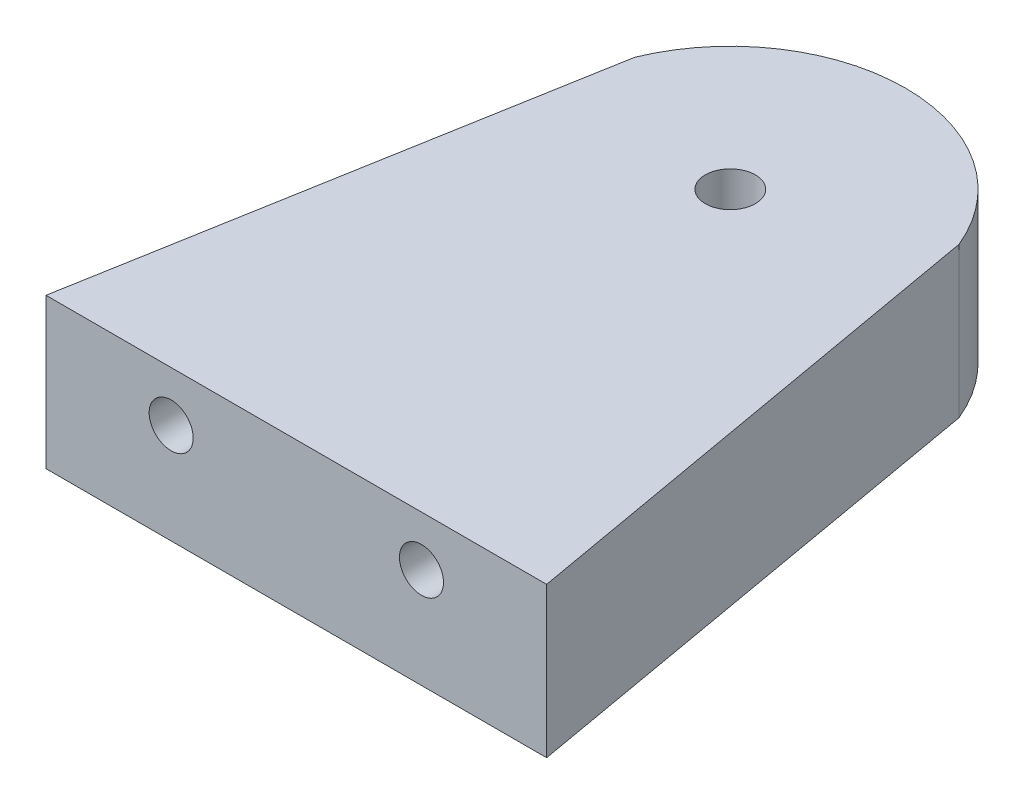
SolidWorks part; units mm, degrees
ref_plane "Alzado" through (0, 0, 0) normal (0, 0, 1) x (1, 0, 0)
ref_plane "Planta" through (0, 0, 0) normal (0, 1, 0) x (1, 0, 0)
ref_plane "Vista lateral" through (0, 0, 0) normal (1, 0, 0) x (0, 0, -1)
sketch "Croquis1" plane through (0, 0, 0) normal (0, 1, 0) x (1, 0, 0)
  line L0 (-50, -50) -> (50, -50)
  line L1 (50, -50) -> (32.3673, 50)
  line L3 (-32.3673, 50) -> (-50, -50)
  arc A0 (-32.3673, 50) -> (32.3673, 50) centre (0, 36.6824) cw
  dimension "D7" = 35
  dimension "D1" = 80
  dimension "D2" = 80
  dimension "D3" = 50
  dimension "D4" = 100
  dimension "D5" = 50
  dimension "D6" = 100
extrude "Extruir1" add sketch "Croquis1" along normal blind 30
hole_wizard "Taladro roscado de M10x1.25-1" positions "Croquis3D1" profile "Croquis4" tap size "M10x1.25" standard "DIN"
sketch3d "Croquis3D1"
  line L0 (-50, 30, 50) -> (-50, 0, 50) construction
  line L1 (-50, 0, 50) -> (50, 0, 50) construction
  point P0 (-25, 20, 50)
  point P2 (25, 20, 50)
  dimension "D1" = 25
  dimension "D2" = 50
  dimension "D3" = 20
  dimension "D4" = 20
sketch "Croquis4" plane through (-25, 20, 50) normal (1, 0, 0) x (0, -1, 0)
  line L0 (0, 0) -> (0, 28.8938)
  line L1 (0, 28.8938) -> (4.4, 26.25)
  line L2 (4.4, 26.25) -> (4.4, 0)
  line L5 (4.4, 0) -> (0, 0)
  line L10 (0, 28.8938) -> (-4.4, 26.25) construction
  line L11 (0, -6.35) -> (0, 107.95) construction
  dimension "Diámetro de perforador para roscar" = 8.8
  dimension "Profundidad de perforador para roscar" = 26.25
  dimension "Ángulo de perforador" = 118
sketch "Croquis5" plane through (0, 30, 0) normal (0, 1, 0) x (1, 0, 0)
  circle A0 centre (0, 36.6824) radius 5
  arc A1 (32.3673, 50) -> (-32.3673, 50) centre (0, 36.6824) ccw construction
  dimension "D1" = 10
extrude "Cortar-Extruir2" cut sketch "Croquis5" against normal blind 40
